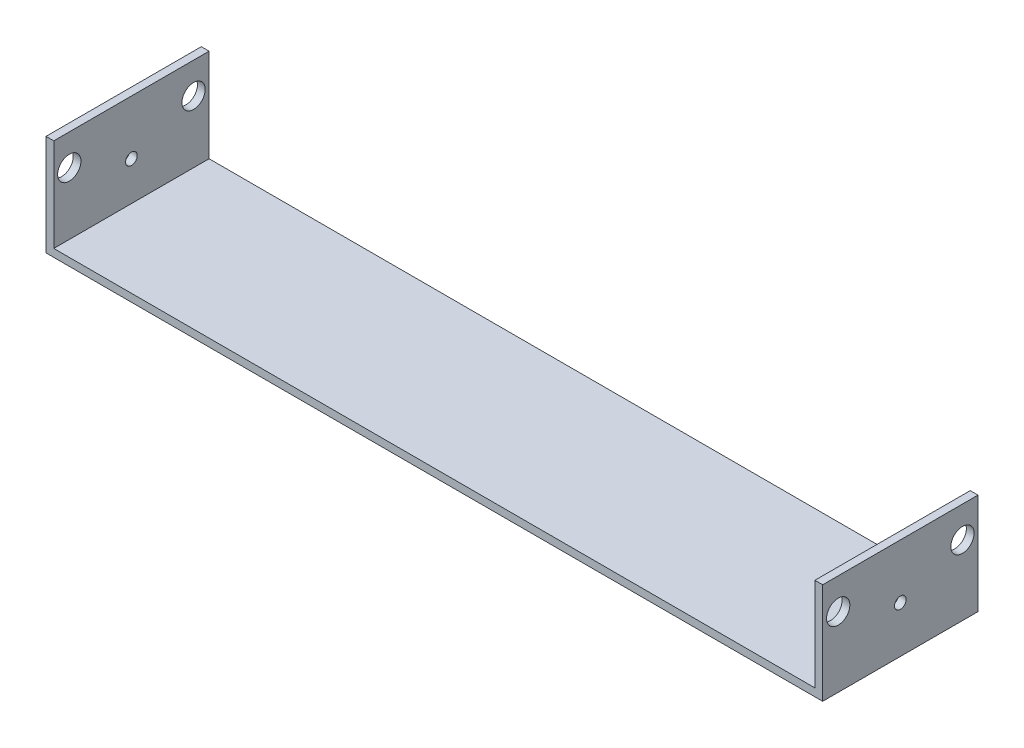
SolidWorks part; units mm, degrees
ref_plane "Front Plane" through (0, 0, 0) normal (0, 0, 1) x (1, 0, 0)
ref_plane "Top Plane" through (0, 0, 0) normal (0, 1, 0) x (1, 0, 0)
ref_plane "Right Plane" through (0, 0, 0) normal (1, 0, 0) x (0, 0, -1)
sketch "Sketch1" plane through (0, 0, 0) normal (0, 1, 0) x (1, 0, 0)
  line L1 (-60.4332, 51.2122) -> (574.5668, 51.2122)
  line L2 (-60.4332, 51.2122) -> (-60.4332, -75.7878)
  line L3 (-60.4332, -75.7878) -> (574.5668, -75.7878)
  line L4 (574.5668, 51.2122) -> (574.5668, -75.7878)
  dimension "D1" = 635
  dimension "D2" = 127
extrude "Extrude1" add sketch "Sketch1" along normal blind 6.35
sketch "Sketch2" plane through (0, 6.35, 0) normal (0, 1, 0) x (-1, 0, 0)
  line L0 (-574.5668, -51.2122) -> (60.4332, -51.2122) construction
  line L1 (-574.5668, 75.7878) -> (-568.2168, 75.7878)
  line L2 (-574.5668, 75.7878) -> (-574.5668, -51.2122)
  line L3 (-574.5668, -51.2122) -> (-568.2168, -51.2122)
  line L4 (-568.2168, 75.7878) -> (-568.2168, -51.2122)
  line L6 (60.4332, 75.7878) -> (54.0832, 75.7878)
  line L7 (60.4332, 75.7878) -> (60.4332, -51.2122)
  line L8 (60.4332, -51.2122) -> (54.0832, -51.2122)
  line L9 (54.0832, 75.7878) -> (54.0832, -51.2122)
  dimension "D1" = 6.35
  dimension "D2" = 6.35
extrude "Extrude2" add sketch "Sketch2" along normal blind 76.2
sketch "Sketch3" plane through (-60.4332, 0, 0) normal (-1, 0, 0) x (0, 0, 1)
  line L0 (75.7878, 82.55) -> (75.7878, 0) construction
  line L1 (-51.2122, 0) -> (75.7878, 0) construction
  circle A0 centre (-38.5122, 57.15) radius 9.525
  circle A1 centre (63.0878, 57.15) radius 9.525
  dimension "D1" = 19.05
  dimension "D2" = 19.05
  dimension "D3" = 101.6
  dimension "D4" = 12.7
  dimension "D5" = 57.15
extrude "Cut-Extrude1" cut sketch "Sketch3" against normal through all
sketch "Sketch4" plane through (-60.4332, 0, 0) normal (-1, 0, 0) x (0, 0, 1)
  line L0 (-51.2122, 82.55) -> (-51.2122, 0) construction
  line L1 (-51.2122, 0) -> (75.7878, 0) construction
  circle A0 centre (12.2878, 38.1) radius 4.7625
  dimension "D1" = 63.5
  dimension "D2" = 38.1
extrude "Cut-Extrude2" cut sketch "Sketch4" against normal through all
